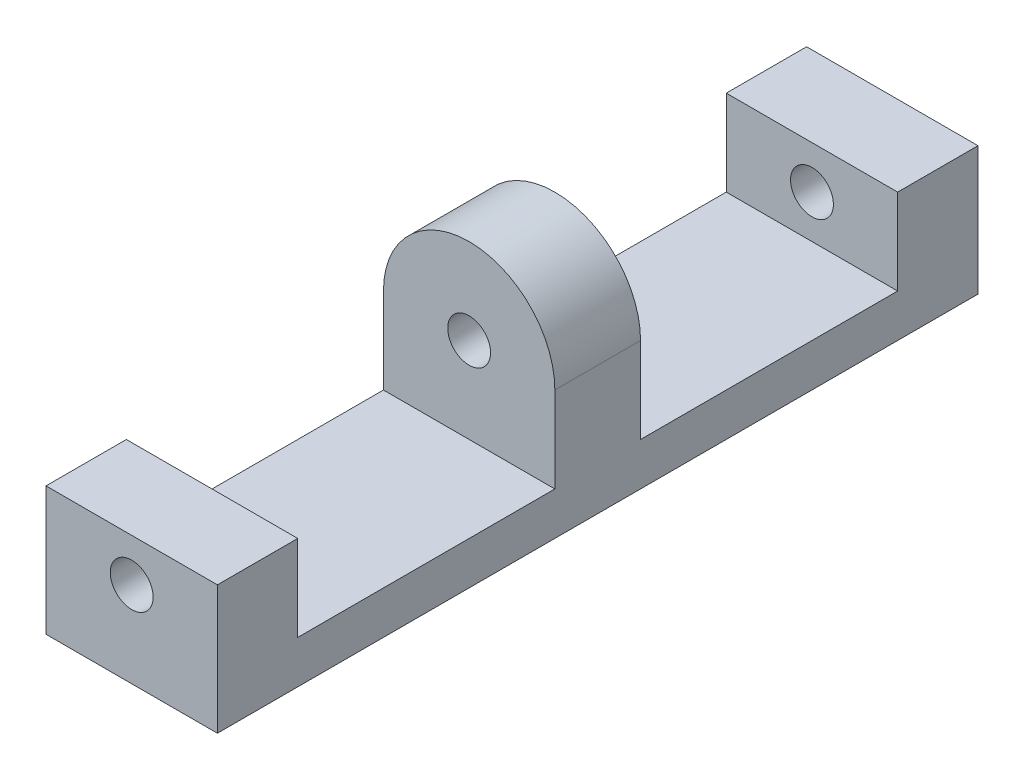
SolidWorks part; units mm, degrees
ref_plane "Front Plane" through (0, 0, 0) normal (0, 0, 1) x (1, 0, 0)
ref_plane "Top Plane" through (0, 0, 0) normal (0, 1, 0) x (1, 0, 0)
ref_plane "Right Plane" through (0, 0, 0) normal (1, 0, 0) x (0, 0, -1)
sketch "Sketch1" plane through (0, 0, 0) normal (0, 0, 1) x (1, 0, 0)
  line L1 (0, 0) -> (50.8, 0)
  line L2 (0, 0) -> (0, 38.1)
  line L3 (0, 38.1) -> (50.8, 38.1)
  line L4 (50.8, 0) -> (50.8, 38.1)
extrude "Extrude1" add sketch "Sketch1" along normal blind 225.425
ref_plane "Plane1" through (0, 0, 112.7125) normal (0, 0, 1) x (1, 0, 0)
sketch "Sketch3" plane through (50.8, 0, 0) normal (1, 0, 0) x (0, 0, -1)
  line L0 (-225.425, 38.1) -> (0, 38.1) construction
  line L1 (-201.6125, 38.1) -> (-23.8125, 38.1)
  line L2 (-201.6125, 38.1) -> (-201.6125, 12.7)
  line L3 (-201.6125, 12.7) -> (-23.8125, 12.7)
  line L4 (-23.8125, 38.1) -> (-23.8125, 12.7)
  line L5 (-112.7125, 27.94) -> (-112.7125, -27.94) construction
  dimension "D1" = 177.8
  dimension "D2" = 88.9
  dimension "D3" = 25.4
extrude "Cut-Extrude1" cut sketch "Sketch3" against normal through all
sketch "Sketch2" plane through (0, 0, 225.425) normal (0, 0, 1) x (1, 0, 0)
  line L0 (0, 38.1) -> (0, 0) construction
  line L4 (0, 0) -> (50.8, 0) construction
  circle A0 centre (25.4, 25.4) radius 6.35
  point P6 (25.4, 0)
extrude "Cut-Extrude2" cut sketch "Sketch2" against normal through all
sketch "Sketch4" plane through (0, 12.7, 0) normal (0, 1, 0) x (-1, 0, 0)
  line L0 (-108.5135, 112.7125) -> (46.7572, 112.7125) construction
  line L1 (0, 23.8125) -> (-50.8, 23.8125) construction
  line L3 (-50.8, 125.4125) -> (0, 125.4125)
  line L4 (-50.8, 100.0125) -> (-50.8, 125.4125)
  line L5 (-50.8, 100.0125) -> (0, 100.0125)
  line L6 (0, 100.0125) -> (0, 125.4125)
  line L7 (0, 201.6125) -> (0, 23.8125) construction
  line L8 (-50.8, 201.6125) -> (-50.8, 23.8125) construction
  dimension "D1" = 88.9
  dimension "D2" = 25.4
extrude "Extrude2" add sketch "Sketch4" along normal blind 50.8
sketch "Sketch5" plane through (0, 0, 125.4125) normal (0, 0, 1) x (1, 0, 0)
  line L5 (50.8, 63.5) -> (50.8, 12.7) construction
  line L6 (0, 63.5) -> (50.8, 63.5) construction
  circle A0 centre (25.4, 38.1) radius 6.35
extrude "Cut-Extrude3" cut sketch "Sketch5" against normal up to next
sketch "Sketch6" plane through (0, 0, 100.0125) normal (0, 0, -1) x (-1, 0, 0)
  line L4 (-50.8, 12.7) -> (0, 12.7)
  line L5 (0, 12.7) -> (0, 63.5)
  line L6 (0, 63.5) -> (-50.8, 63.5)
  line L7 (-50.8, 63.5) -> (-50.8, 12.7)
  line L9 (0, 12.7) -> (0, 38.1) construction
  line L10 (-25.4, 63.5) -> (-50.8, 63.5) construction
  line L11 (-50.8, 63.5) -> (-50.8, 38.1) construction
  arc A0 (0, 38.1) -> (-50.8, 38.1) centre (-25.4, 38.1) ccw
  dimension "D1" = 0
extrude "Cut-Extrude4" cut sketch "Sketch6" against normal through all and the other way through all flip side to cut
equation "\"D1@Sketch2\" = \"D1@Sketch1\" / 2"
equation "\"D2@Sketch5\" = \"D1@Sketch1\" / 2"
